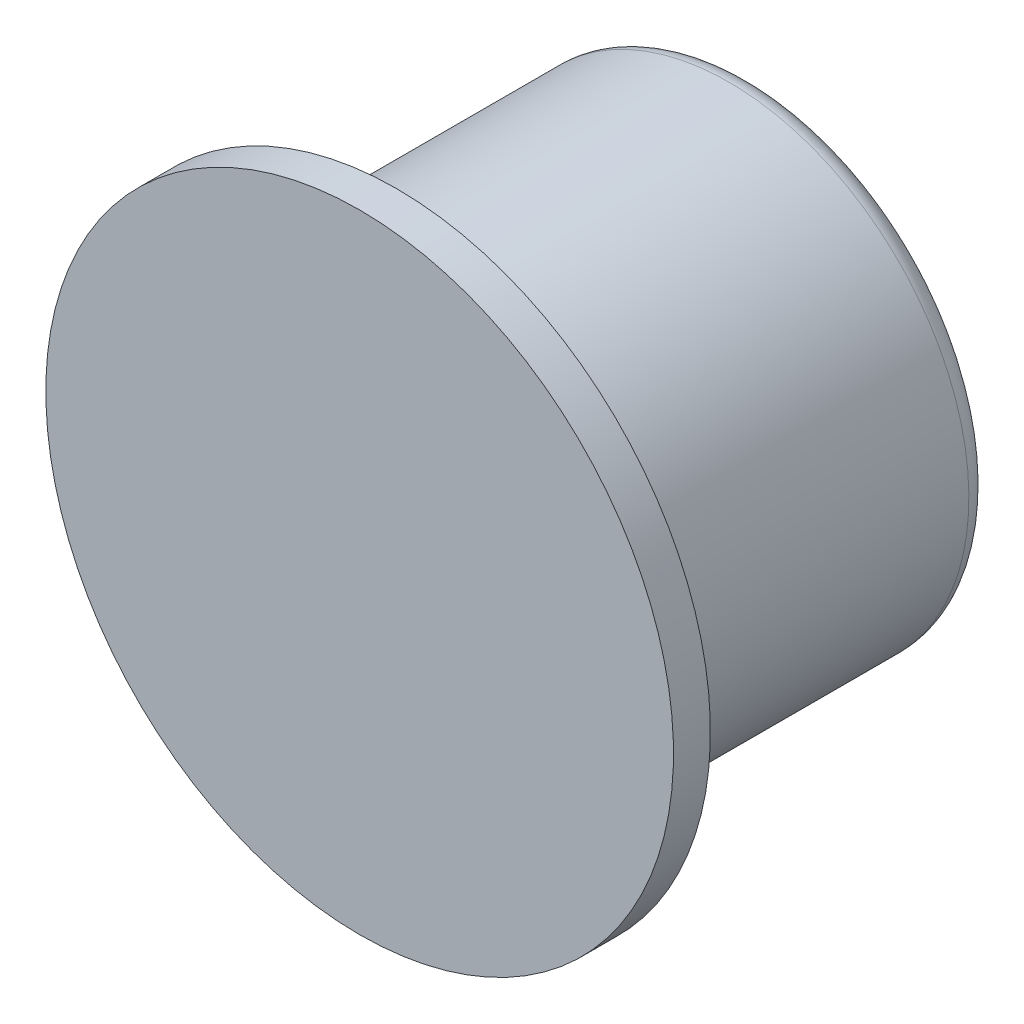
SolidWorks part; units mm, degrees
ref_plane "Front Plane" through (0, 0, 0) normal (0, 0, 1) x (1, 0, 0)
ref_plane "Top Plane" through (0, 0, 0) normal (0, 1, 0) x (1, 0, 0)
ref_plane "Right Plane" through (0, 0, 0) normal (1, 0, 0) x (0, 0, -1)
sketch "Sketch1" plane through (0, 0, 0) normal (1, 0, 0) x (0, 0, -1)
  line L0 (0, 0) -> (54.7136, 0) construction
  line L1 (0, 0) -> (0, 42.5)
  line L2 (0, 42.5) -> (5, 42.5)
  line L3 (5, 42.5) -> (5, 32.5)
  line L4 (5, 32.5) -> (50, 32.5)
  line L5 (53, 29.5) -> (53, 4.5)
  line L6 (52.5, 4) -> (44, 4)
  line L7 (44, 4) -> (41.6906, 0)
  line L8 (53, 4.5) -> (52.5, 4)
  line L9 (0, 0) -> (41.6906, 0)
  arc A0 (50, 32.5) -> (53, 29.5) centre (50, 29.5) cw
  point P13 (53, 32.5)
  dimension "D10" = 3
  dimension "D1" = 45
  dimension "D2" = 0.5
  dimension "D3" = 9
  dimension "D4" = 60
  dimension "D5" = 4
  dimension "D6" = 5
  dimension "D7" = 48
  dimension "D8" = 32.5
  dimension "D9" = 42.5
revolve "Revolve1" add sketch "Sketch1" angle 360 about L0
